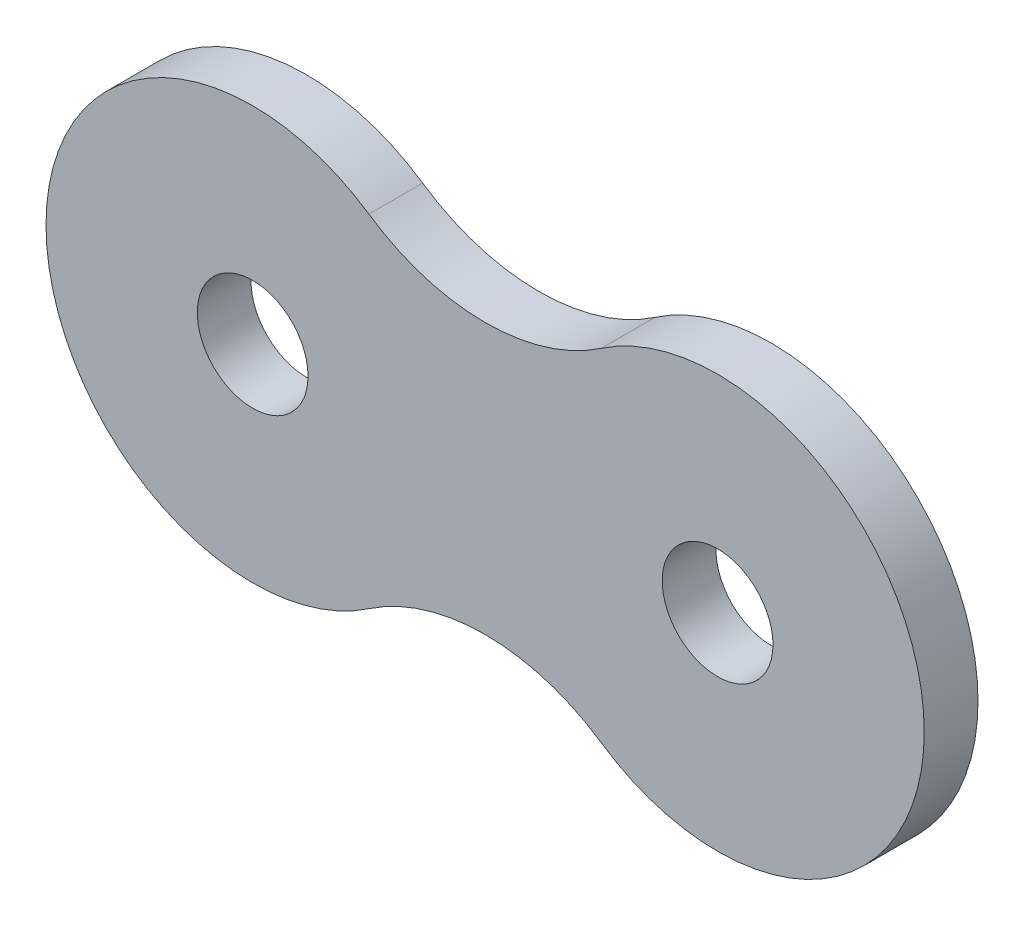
SolidWorks part; units mm, degrees
ref_plane "Plan de face" through (0, 0, 0) normal (0, 0, 1) x (1, 0, 0)
ref_plane "Plan de dessus" through (0, 0, 0) normal (0, 1, 0) x (1, 0, 0)
ref_plane "Plan de droite" through (0, 0, 0) normal (1, 0, 0) x (0, 0, -1)
sketch "Esquisse1" plane through (0, 0, 0) normal (0, 0, 1) x (1, 0, 0)
  line L0 (-69.6461, 0) -> (-10.8962, 0) construction
  arc A0 (-44.8336, 7.0006) -> (-44.8336, -7.0006) centre (-49.5961, 0) ccw
  arc A1 (-35.3086, -7.0006) -> (-35.3086, 7.0006) centre (-30.5461, 0) ccw
  arc A2 (-44.8336, 7.0006) -> (-35.3086, 7.0006) centre (-40.0711, 14.0012) ccw
  arc A3 (-44.8336, -7.0006) -> (-35.3086, -7.0006) centre (-40.0711, -14.0012) cw
  circle A4 centre (-49.5961, 0) radius 2.269
  circle A5 centre (-30.5461, 0) radius 2.269
  dimension "D1" = 16.934
  dimension "D2" = 16.934
  dimension "D3" = 19.05
  dimension "D4" = 16.934
  dimension "D5" = 4.538
  dimension "D6" = 4.538
extrude "Boss.-Extru.1" add sketch "Esquisse1" along normal blind 2.202
